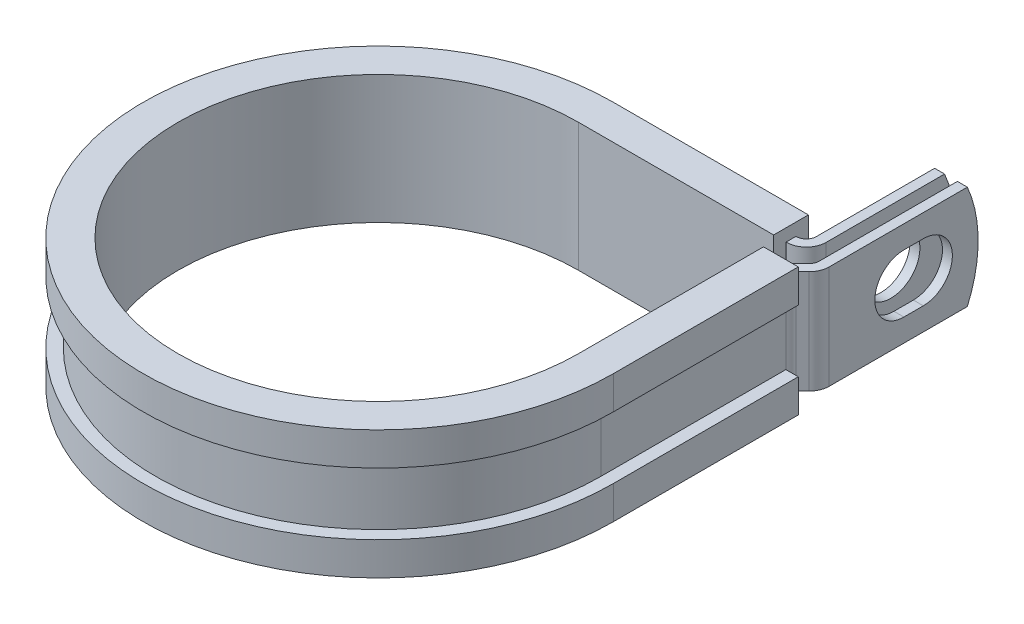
SolidWorks part; units mm, degrees
ref_plane "Front Plane" through (0, 0, 0) normal (0, 0, 1) x (1, 0, 0)
ref_plane "Top Plane" through (0, 0, 0) normal (0, 1, 0) x (1, 0, 0)
ref_plane "Right Plane" through (0, 0, 0) normal (1, 0, 0) x (0, 0, -1)
sketch "Sketch1" plane through (0, 0, 0) normal (0, 1, 0) x (1, 0, 0)
  line L0 (0, 26.1239) -> (24.0082, 26.1239)
  line L1 (26.1239, 0) -> (26.1239, 22.7114)
  line L2 (26.4466, 44.4246) -> (26.4466, 28.5623)
  line L3 (26.8381, 24.4356) -> (27.6643, 25.2618)
  line L5 (28.0214, 26.1239) -> (28.0214, 44.4246)
  arc A0 (0, 26.1239) -> (26.1239, 0) centre (0, 0) ccw
  arc A1 (26.8381, 24.4356) -> (26.1239, 22.7114) centre (28.5623, 22.7114) ccw
  arc A2 (27.6643, 25.2618) -> (28.0214, 26.1239) centre (26.8022, 26.1239) ccw
  arc A3 (24.0082, 26.1239) -> (26.4466, 28.5623) centre (24.0082, 28.5623) ccw
extrude "Extrude-Thin1" add sketch "Sketch1" along normal mid plane 12.7 thin
sketch "Sketch2" plane through (25.2274, 0, 0) normal (-1, 0, 0) x (0, 0, 1)
  line L0 (-44.4246, 6.35) -> (-44.4246, -6.35) construction
  line L1 (0, 6.35) -> (0, -6.35) construction
  circle A0 centre (-36.4998, 0) radius 3.5687
  point P2 (-44.4246, 0)
extrude "Cut-Extrude1" cut sketch "Sketch2" against normal up to surface (1.2192 mm away)
sketch "Sketch3" plane through (29.2406, 0, 0) normal (1, 0, 0) x (0, 0, -1)
  line L0 (35.306, 0) -> (37.6936, 0) construction
  line L1 (35.306, 3.5687) -> (37.6936, 3.5687)
  line L2 (35.306, -3.5687) -> (37.6936, -3.5687)
  line L3 (44.4246, 6.35) -> (44.4246, -6.35) construction
  arc A0 (35.306, 3.5687) -> (35.306, -3.5687) centre (35.306, 0) ccw
  arc A1 (37.6936, -3.5687) -> (37.6936, 3.5687) centre (37.6936, 0) ccw
  point P3 (36.4998, 0)
  point P8 (44.4246, 0)
  point P11 (31.7373, 0)
  point P12 (41.2623, 0)
extrude "Cut-Extrude2" cut sketch "Sketch3" against normal up to surface (1.2192 mm away)
sketch "Sketch4" plane through (25.2274, 0, 0) normal (-1, 0, 0) x (0, 0, 1)
  line L0 (-44.4246, 6.35) -> (-44.4246, -6.35)
  line L1 (-44.4246, 6.35) -> (-43.0993, 6.35)
  line L2 (-44.4246, 6.35) -> (-28.5623, 6.35) construction
  line L3 (-44.4246, -6.35) -> (-43.0993, -6.35)
  line L4 (-44.4246, -6.35) -> (-28.5623, -6.35) construction
  arc A0 (-43.0993, 6.35) -> (-43.0993, -6.35) centre (-28.5496, 0) ccw
extrude "Cut-Extrude3" cut sketch "Sketch4" against normal through all contours A0 M4 M5 | A0 L0 M2
ref_plane "Plane1" through (0, 0, -22.7114) normal (0, 0, -1) x (-1, 0, 0)
ref_plane "Plane2" through (23.9574, 0, 0) normal (-1, 0, 0) x (0, 0, 1)
sketch "Sketch5" plane through (0, 0, -22.7114) normal (0, 0, -1) x (-1, 0, 0)
  line L0 (-27.3431, 6.35) -> (-26.1239, 6.35)
  line L1 (-27.3431, 6.35) -> (-27.3431, -6.35) construction
  line L3 (-26.1239, 6.35) -> (-26.1239, -6.35)
  line L4 (-26.1239, -6.35) -> (-27.3431, -6.35)
  line L5 (-27.3431, -6.35) -> (-27.3431, -3.81)
  line L6 (-27.3431, 6.35) -> (-27.3431, 3.81)
  line L7 (-28.8671, 7.874) -> (-28.8671, 3.81)
  line L8 (-28.8671, 7.874) -> (-24.5999, 7.874)
  line L9 (-24.5999, 7.874) -> (-24.5999, -7.874)
  line L10 (-24.5999, -7.874) -> (-28.8671, -7.874)
  line L11 (-28.8671, -7.874) -> (-28.8671, -3.81)
  line L12 (-28.8671, 3.81) -> (-27.3431, 3.81)
  line L13 (-27.3431, -3.81) -> (-28.8671, -3.81)
sketch "Sketch6" plane through (0, 6.35, 0) normal (0, 1, 0) x (1, 0, 0)
  line L0 (24.5999, 0) -> (24.5999, 22.7114)
  line L1 (24.5999, 22.7114) -> (28.8671, 22.7114) construction
  line L2 (23.9574, 6.9878) -> (23.9574, -6.9878) construction
  line L5 (0, 24.5999) -> (23.9574, 24.5999)
  arc A0 (0, 24.5999) -> (24.5999, 0) centre (0, 0) ccw
sweep "Sweep1" add profiles "Sketch5" path "Sketch6"
equation "\"D4@Sketch5\" = \"D1@Extrude-Thin1\""
equation "\"D5@Sketch5\" = \"D5@Extrude-Thin1\""
equation "\"D1@Sketch3\" = \"D2@Sketch2\""
equation "\"D7@Sketch1\" = \"D3@Sketch2\" + \"D1@Sketch3\""
equation "\"D1@Sketch1\" = \"D1@Sketch6\" + 2 * \"D3@Sketch5\""
equation "\"D1@Sketch4\" = ( \"D1@Extrude-Thin1\" + .125 ) * 2"
equation "\"D9@Sketch1\"= \"D5@Extrude-Thin1\""
equation "\"D8@Sketch1\"= 2 * \"D5@Extrude-Thin1\""
equation "\"D2@Sketch1\" = 2 * \"D5@Extrude-Thin1\""
equation "\"D2@Sketch3\" = \"D1@Sketch2\""
